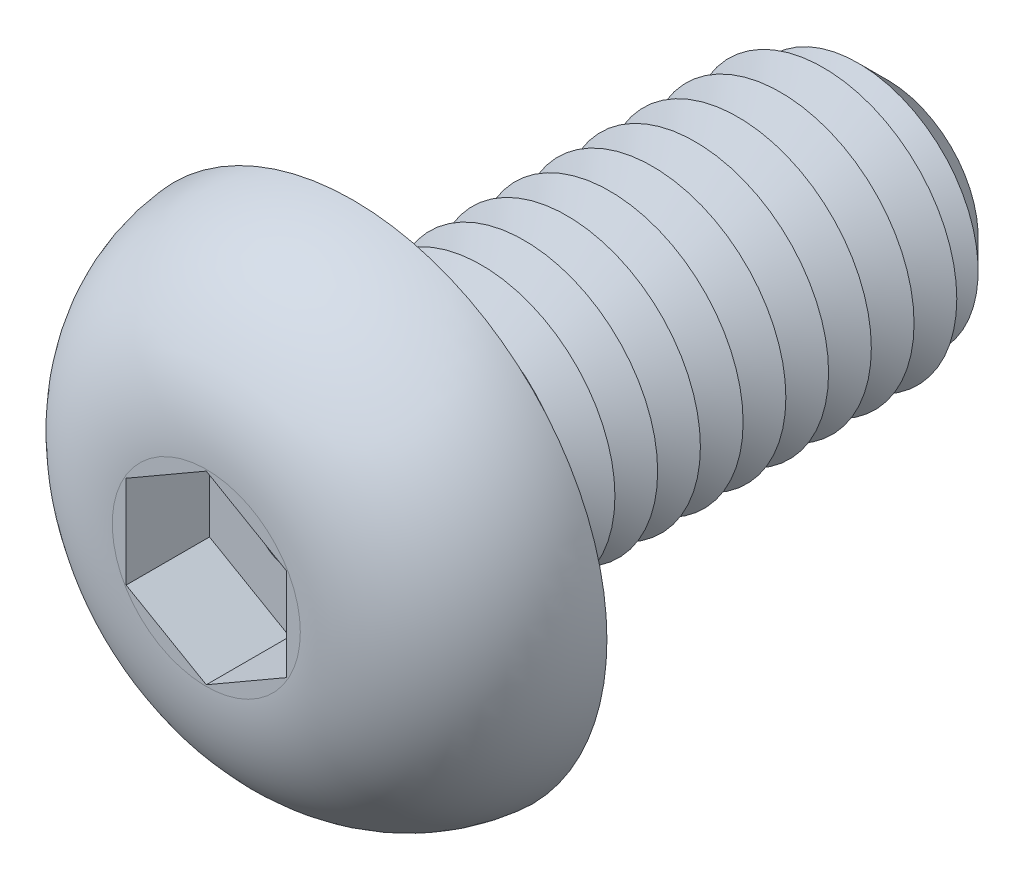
SolidWorks part; units mm, degrees
ref_plane "Front Plane" through (0, 0, 0) normal (0, 0, 1) x (1, 0, 0)
ref_plane "Top Plane" through (0, 0, 0) normal (0, 1, 0) x (1, 0, 0)
ref_plane "Right Plane" through (0, 0, 0) normal (1, 0, 0) x (0, 0, -1)
sketch "Sketch1" plane through (0, 0, 0) normal (1, 0, 0) x (0, 0, -1)
  line L0 (-47.9342, 0) -> (60.3146, 0) construction
sketch "Sketch2" plane through (0, 0, 0) normal (1, 0, 0) x (0, 0, -1)
  line L0 (0, 0) -> (-2.75, 0)
  line L1 (-47.9342, 0) -> (60.3146, 0) construction
  line L2 (-2.75, 0) -> (-2.75, 1.7604)
  line L3 (0, 4.75) -> (0, 0)
  arc A0 (-2.75, 1.7604) -> (0, 4.75) centre (0.25, 1.7604) cw
  dimension "D1" = 3
  dimension "D2" = 2.75
  dimension "D3" = 4.75
revolve "Revolve1" add sketch "Sketch2" angle 360 about L0
sketch "Sketch3" plane through (0, 0, 2.75) normal (0, 0, 1) x (1, 0, 0)
  line L1 (0, 1.7321) -> (-1.5, 0.866)
  line L2 (-1.5, 0.866) -> (-1.5, -0.866)
  line L3 (-1.5, -0.866) -> (0, -1.7321)
  line L4 (0, -1.7321) -> (1.5, -0.866)
  line L5 (1.5, -0.866) -> (1.5, 0.866)
  line L6 (1.5, 0.866) -> (0, 1.7321)
  circle A0 centre (0, 0) radius 1.5 construction
  dimension "D1" = 3
extrude "Cut-Extrude1" cut sketch "Sketch3" against normal blind 1.56
sketch "Sketch4" plane through (0, 0, 0) normal (0, 0, -1) x (-1, 0, 0)
  circle A0 centre (0, 0) radius 2.5
  dimension "D1" = 5
extrude "Boss-Extrude1" add sketch "Sketch4" along normal blind 10
chamfer "Chamfer1" distance 0.8 angle 45 1 edges at (-2.5, 0, -10)
sketch "Sketch5" plane through (0, 0, 0) normal (1, 0, 0) x (0, 0, -1)
  line L0 (0.8, 2.5) -> (1.6, 2.5)
  line L1 (9.2, 2.5) -> (0, 2.5) construction
  line L2 (1.6, 2.5) -> (1.2, 1.8072)
  line L3 (1.2, 1.8072) -> (0.8, 2.5)
  line L4 (0, -4.75) -> (0, 4.75) construction
  line L5 (9.2, 2.5) -> (0, 2.5) construction
  dimension "D1" = 0.8
  dimension "D2" = 0.8
revolve "Cut-Revolve1" cut sketch "Sketch5" angle 360 about L0
pattern_linear "LPattern1" count 11 spacing 0.8 along (0, 0, -1) of "Cut-Revolve1"
fillet "Fillet2" radius 0.4 1 edges at (2.5, 0, 0)
sketch "Sketch6" plane through (0, 0, 1.19) normal (0, 0, 1) x (1, 0, 0)
  circle A0 centre (0, 0) radius 0.65
  dimension "D1" = 1.3
extrude "Cut-Extrude2" cut sketch "Sketch6" against normal up to surface (11.19 mm away)
